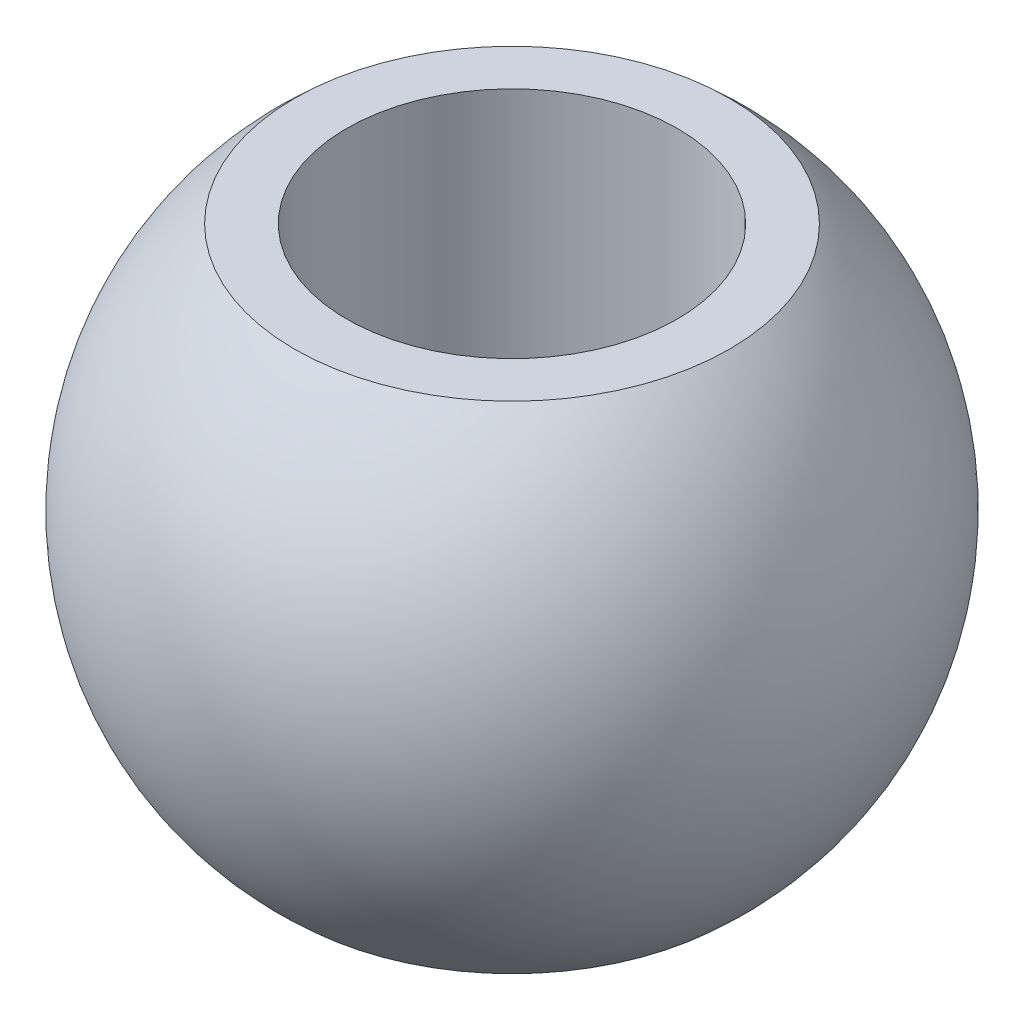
SolidWorks part; units mm, degrees
ref_plane "Front Plane" through (0, 0, 0) normal (0, 0, 1) x (1, 0, 0)
ref_plane "Top Plane" through (0, 0, 0) normal (0, 1, 0) x (1, 0, 0)
ref_plane "Right Plane" through (0, 0, 0) normal (1, 0, 0) x (0, 0, -1)
sketch "Sketch1" plane through (0, 0, 0) normal (0, 0, 1) x (1, 0, 0)
  line L0 (-4, 6) -> (-4, -6)
  line L1 (-4, -6) -> (-5.2612, -6)
  line L3 (-5.2612, 6) -> (-4, 6)
  line L4 (0, 0) -> (0, 8.2021) construction
  arc A0 (-5.2612, 6) -> (-5.2612, -6) centre (0, 0) ccw
  point P9 (-4, 0)
  dimension "D1" = 7.98
  dimension "D2" = 12
  dimension "D3" = 4
revolve "Revolve1" add sketch "Sketch1" angle 360 about L4
ref_point "Point1"
